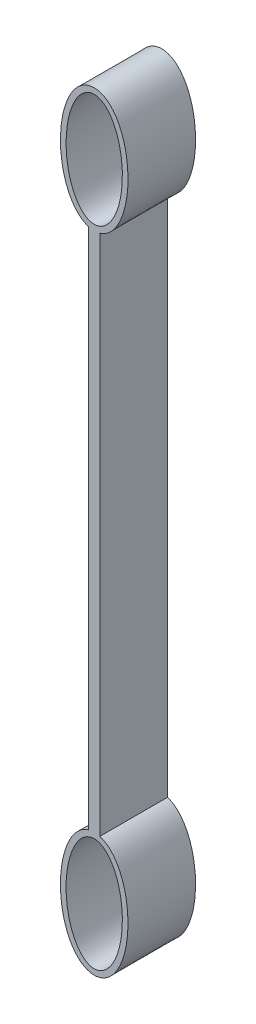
SolidWorks part; units mm, degrees
ref_plane "Front Plane" through (0, 0, 0) normal (0, 0, 1) x (1, 0, 0)
ref_plane "Top Plane" through (0, 0, 0) normal (0, 1, 0) x (1, 0, 0)
ref_plane "Right Plane" through (0, 0, 0) normal (1, 0, 0) x (0, 0, -1)
sketch "Sketch1" plane through (0, 0, 0) normal (1, 0, 0) x (0, 0, -1)
  line L0 (0, 300) -> (0, -300) construction
  line L1 (-38.1, 300) -> (38.1, 300)
  line L2 (-38.1, 300) -> (-38.1, -300)
  line L3 (-38.1, -300) -> (38.1, -300)
  line L4 (38.1, 300) -> (38.1, -300)
  dimension "D1" = 76.2
  dimension "D2" = 600
extrude "Boss-Extrude1" add sketch "Sketch1" along normal mid plane 12.7
sketch "Sketch2" plane through (0, 0, 0) normal (0, 0, 1) x (1, 0, 0)
  line L0 (6.35, 300) -> (-6.35, 300) construction
  line L1 (0, 363.5) -> (0, 0) construction
  line L2 (0, 0) -> (124.7575, 0) construction
  ellipse E0 centre (0, 363.5) end of major axis (0, 300) minor radius 31.75
  ellipse E2 centre (0, -363.5) end of major axis (0, -300) minor radius 31.75
  point P11 (0, 293.65)
  point P12 (0, -293.65)
  dimension "D1" = 6.35
  dimension "D2" = 63.5
  dimension "D3" = 127
extrude "Boss-Extrude2" add sketch "Sketch2" along normal mid plane 76.2
